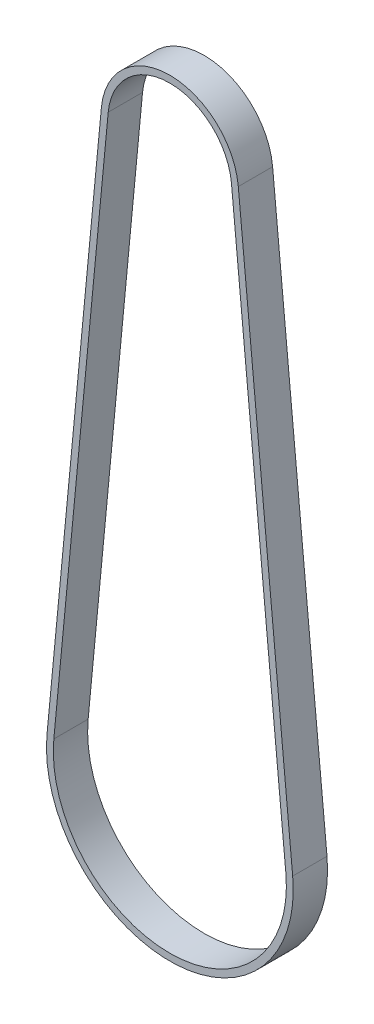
SolidWorks part; units mm, degrees
ref_plane "Plan de face" through (0, 0, 0) normal (0, 0, 1) x (1, 0, 0)
ref_plane "Plan de dessus" through (0, 0, 0) normal (0, 1, 0) x (1, 0, 0)
ref_plane "Plan de droite" through (0, 0, 0) normal (1, 0, 0) x (0, 0, -1)
sketch "Esquisse1" plane through (0, 0, 0) normal (0, 0, 1) x (1, 0, 0)
  line L0 (26.9327, 253.9397) -> (50.6998, 4.8373)
  line L1 (-26.9327, 253.9397) -> (-50.6998, 4.8373)
  line L2 (29.9191, 254.2246) -> (53.6862, 5.1222)
  line L3 (-29.9191, 254.2246) -> (-53.6862, 5.1222)
  line L4 (0, 0) -> (0, 251.37) construction
  arc A1 (26.9327, 253.9397) -> (-26.9327, 253.9397) centre (0, 251.37) ccw
  arc A3 (-50.6998, 4.8373) -> (50.6998, 4.8373) centre (0, 0) ccw
  arc A4 (-53.6862, 5.1222) -> (53.6862, 5.1222) centre (0, 0) ccw
  arc A5 (29.9191, 254.2246) -> (-29.9191, 254.2246) centre (0, 251.37) ccw
  dimension "D2" = 27.055
  dimension "D3" = 50.93
  dimension "D4" = 251.37
  dimension "D1" = 3
extrude "Extrusion1" add sketch "Esquisse1" against normal blind 15
